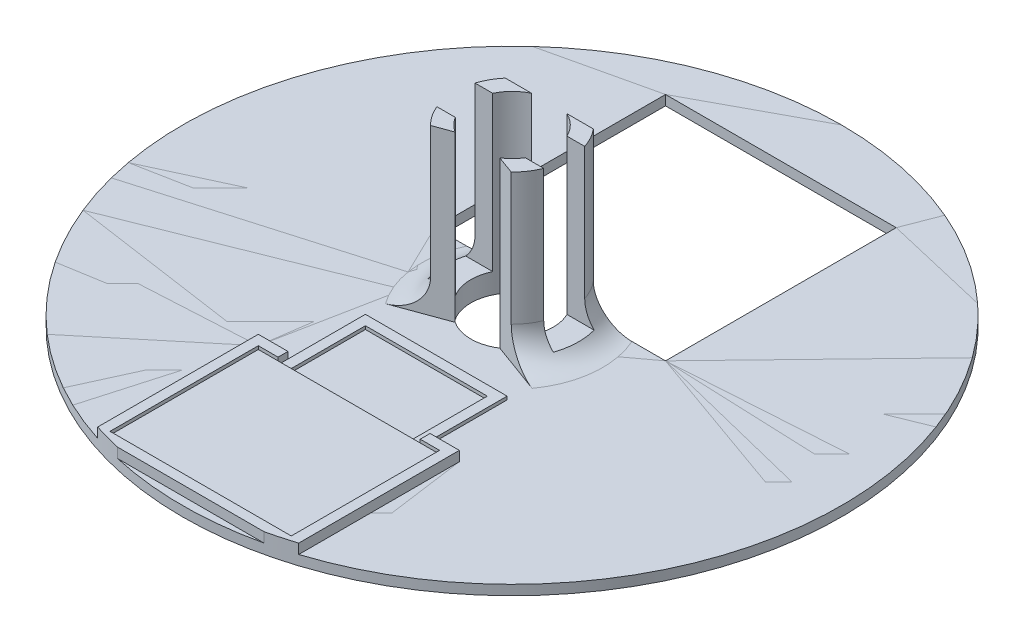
SolidWorks part; units mm, degrees
ref_plane "Front Plane" through (0, 0, 0) normal (0, 0, 1) x (1, 0, 0)
ref_plane "Top Plane" through (0, 0, 0) normal (0, 1, 0) x (1, 0, 0)
ref_plane "Right Plane" through (0, 0, 0) normal (1, 0, 0) x (0, 0, -1)
sketch "Sketch1" plane through (0, 0, 0) normal (0, 1, 0) x (1, 0, 0)
  line L0 (0.2653, 99.9996) -> (0.2653, 46.2996) construction
  line L5 (5.3449, 11.2996) -> (35.2653, 11.2996)
  line L6 (-34.7347, 81.2996) -> (35.2653, 81.2996)
  line L16 (-34.7347, 81.2996) -> (-34.7347, 11.2996)
  line L17 (-34.7347, 11.2996) -> (-5.3449, 11.2996)
  line L18 (35.2653, 81.2996) -> (35.2653, 11.2996)
  line L19 (-34.7347, 81.2996) -> (35.2653, 11.2996) construction
  line L20 (-34.7347, 11.2996) -> (35.2653, 81.2996) construction
  line L21 (0.2653, -12.4972) -> (0.2653, -99.6486) construction
  circle A0 centre (0, 0) radius 100
  arc A3 (-5.3449, 11.2996) -> (5.3449, 11.2996) centre (0, 0) ccw
  point P5 (0.2653, 46.2996)
  dimension "D1" = 200
  dimension "D5" = 25
  dimension "D2" = 70
  dimension "D3" = 70
  dimension "D4" = 53.7
extrude "Boss-Extrude1" add sketch "Sketch1" along normal blind 3
sketch "Sketch2" plane through (0, 3, 0) normal (0, 1, 0) x (1, 0, 0)
  line L0 (-6.7823, -10.5) -> (-12.2474, -12.5)
  line L1 (6.7823, -10.5) -> (12.2474, -12.5)
  line L4 (5.3449, 11.2996) -> (13.3629, 11.2996)
  line L5 (5.3449, 11.2996) -> (35.2653, 11.2996) construction
  line L6 (-5.3449, 11.2996) -> (-13.3629, 11.2996)
  line L7 (-34.7347, 11.2996) -> (-5.3449, 11.2996) construction
  arc A0 (12.2474, -12.5) -> (13.3629, 11.2996) centre (0, 0) ccw
  arc A1 (6.7823, -10.5) -> (5.3449, 11.2996) centre (0, 0) ccw
  arc A2 (-5.3449, 11.2996) -> (-6.7823, -10.5) centre (0, 0) ccw
  arc A3 (-13.3629, 11.2996) -> (-12.2474, -12.5) centre (0, 0) ccw
  dimension "D1" = 25
  dimension "D2" = 5
extrude "Boss-Extrude2" add sketch "Sketch2" along normal blind 50
fillet "Fillet1" radius 10 1 edges at (17.4808, 3, 0.8193)
fillet "Fillet2" radius 10 1 edges at (-17.4808, 3, 0.8193)
sketch "Sketch3" plane through (0, 3, 0) normal (0, 1, 0) x (1, 0, 0)
  line L0 (0, 0) -> (100, 0) construction
  line L1 (0, 0) -> (0, -49.5) construction
  line L6 (-21.5, -23.0004) -> (-21.5, -49.5)
  line L12 (21.5, -23.0004) -> (21.5, -49.5)
  line L13 (-21.5, -23.0004) -> (21.5, -23.0004)
  line L14 (-21.5, -52.0004) -> (21.5, -52.0004) construction
  line L15 (-27.5, -49.5) -> (-21.5, -49.5)
  line L16 (-27.5, -49.5) -> (-27.5, -94.5)
  line L17 (-27.5, -94.5) -> (27.5, -94.5)
  line L18 (27.5, -49.5) -> (27.5, -94.5)
  line L19 (-27.5, -49.5) -> (27.5, -94.5) construction
  line L20 (-27.5, -94.5) -> (0, -72) construction
  line L21 (-18.5, -26.0004) -> (18.5, -26.0004)
  line L22 (-18.5, -26.0004) -> (-18.5, -49.0004)
  line L24 (18.5, -26.0004) -> (18.5, -49.0004)
  line L25 (-18.5, -26.0004) -> (18.5, -49.0004) construction
  line L26 (-18.5, -49.0004) -> (18.5, -26.0004) construction
  line L27 (0, -72) -> (0, -100) construction
  line L28 (-21.5, -23.0004) -> (-21.5, -52.0004) construction
  line L29 (21.5, -49.5) -> (27.5, -49.5)
  line L30 (-18.5, -49.0004) -> (18.5, -49.0004) construction
  line L31 (21.5, -23.0004) -> (21.5, -52.0004) construction
  line L32 (-18.5, -49.0004) -> (18.5, -49.0004)
  circle A0 centre (0, 0) radius 100 construction
  point P11 (0, -37.5004)
  point P18 (0, -72)
  point P27 (-18.5, -37.5004)
  dimension "D1" = 3
  dimension "D5" = 72
  dimension "D6" = 55
  dimension "D7" = 45
  dimension "D8" = 23
  dimension "D9" = 37
extrude "Boss-Extrude3" add sketch "Sketch3" along normal blind 1
sketch "Sketch4" plane through (0, 3, 0) normal (0, 1, 0) x (1, 0, 0)
  line L0 (-27.5, -94.5) -> (27.5, -94.5) construction
  line L1 (-27.5, -49.5) -> (-21.5, -49.5)
  line L2 (-27.5, -49.5) -> (-27.5, -94.5)
  line L3 (-27.5, -94.5) -> (27.5, -94.5)
  line L4 (27.5, -49.5) -> (27.5, -94.5)
  line L5 (-27.5, -94.5) -> (27.5, -94.5) construction
  line L6 (-30.5, -46.5) -> (-30.5, -95.2352)
  line L7 (-22.2205, -97.5) -> (22.2205, -97.5)
  line L8 (30.5, -46.5) -> (30.5, -95.2352)
  line L9 (-30.5, -46.5) -> (-21.5, -46.5)
  line L10 (-30.5, -97.5) -> (30.5, -97.5) construction
  line L11 (30.5, -46.5) -> (30.5, -97.5) construction
  line L12 (-30.5, -46.5) -> (-30.5, -97.5) construction
  line L13 (-21.5, -46.5) -> (-21.5, -49.5)
  line L14 (-21.5, -23.0004) -> (-21.5, -49.5) construction
  line L15 (21.6278, -49.5) -> (21.6278, -46.5)
  line L16 (21.6278, -46.5) -> (30.5, -46.5)
  line L17 (-30.5, -46.5) -> (30.5, -46.5) construction
  line L18 (21.6278, -49.5) -> (27.5, -49.5)
  line L19 (-27.5, -49.5) -> (27.5, -49.5) construction
  arc A0 (-30.5, -95.2352) -> (-22.2205, -97.5) centre (0, 0) ccw
  arc A1 (22.2205, -97.5) -> (30.5, -95.2352) centre (0, 0) ccw
  dimension "D1" = 3
extrude "Boss-Extrude4" add sketch "Sketch4" along normal blind 3
sketch "Sketch5" plane through (0, 4, 0) normal (0, 1, 0) x (1, 0, 0)
  line L0 (27.5, -94.5) -> (-27.5, -94.5) construction
  line L1 (-27.5, -49.5) -> (27.5, -49.5)
  line L2 (-27.5, -49.5) -> (-27.5, -94.5)
  line L3 (-27.5, -94.5) -> (27.5, -94.5)
  line L4 (27.5, -49.5) -> (27.5, -94.5)
  line L5 (-27.5, -94.5) -> (27.5, -94.5) construction
extrude "Boss-Extrude5" add sketch "Sketch5" along normal blind 1
sketch "Sketch6" plane through (0, 0, 0) normal (1, 0, 0) x (0, 0, -1)
  line L0 (11.2996, 53) -> (-12.5, 53) construction
  line L1 (-6.6002, 99.8617) -> (5.3998, 99.8617)
  line L2 (-6.6002, 99.8617) -> (-6.6002, 6.1383)
  line L3 (-6.6002, 6.1383) -> (5.3998, 6.1383)
  line L4 (5.3998, 99.8617) -> (5.3998, 6.1383)
  line L5 (-6.6002, 99.8617) -> (5.3998, 6.1383) construction
  line L6 (-6.6002, 6.1383) -> (5.3998, 99.8617) construction
  point P0 (-0.6002, 53)
  dimension "D1" = 12
extrude "Cut-Extrude2" cut sketch "Sketch6" against normal through all both and the other way through all
surface "Surface-Knit1"
surface "Surface-Knit2"
